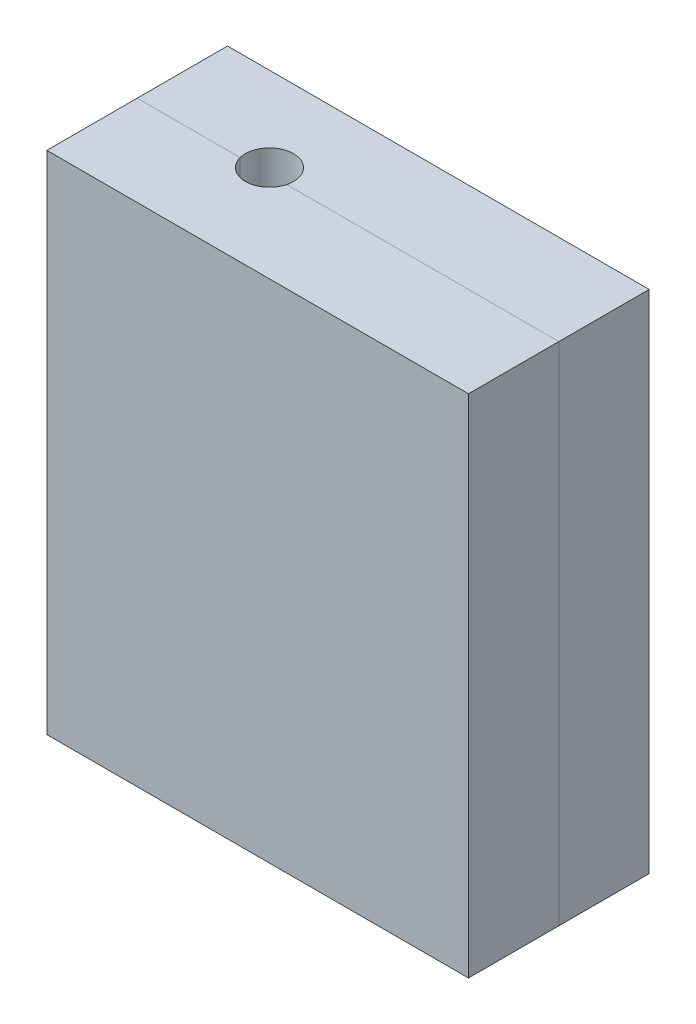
SolidWorks part; units mm, degrees
ref_plane "Front Plane" through (0, 0, 0) normal (0, 0, 1) x (1, 0, 0)
ref_plane "Top Plane" through (0, 0, 0) normal (0, 1, 0) x (1, 0, 0)
ref_plane "Right Plane" through (0, 0, 0) normal (1, 0, 0) x (0, 0, -1)
sketch "Sketch1" plane through (0, 0, 0) normal (0, 0, 1) x (1, 0, 0)
  line L1 (0, 0) -> (250, 0)
  line L2 (0, 0) -> (0, 300)
  line L3 (0, 300) -> (250, 300)
  line L4 (250, 0) -> (250, 300)
  dimension "D1" = 250
  dimension "D2" = 300
sketch "Sketch2" plane through (0, 0, 0) normal (0, 0, 1) x (1, 0, 0)
  line L0 (0, 280) -> (0, 20)
  line L1 (20, 0) -> (230, 0)
  line L2 (250, 20) -> (250, 280)
  line L3 (230, 300) -> (70, 300)
  line L4 (35, 300) -> (35, 320)
  line L5 (35, 320) -> (70, 320)
  line L6 (70, 320) -> (70, 300)
  line L8 (215, 67.5) -> (200, 67.5)
  line L9 (200, 67.5) -> (155, 112.5)
  line L10 (155, 112.5) -> (155, 187.5)
  line L11 (155, 187.5) -> (200, 232.5)
  line L12 (200, 232.5) -> (215, 232.5)
  line L13 (215, 150) -> (155, 150) construction
  line L14 (215, 232.5) -> (215, 67.5)
  line L15 (35, 300) -> (20, 300)
  arc A0 (0, 20) -> (20, 0) centre (20, 20) ccw
  arc A1 (230, 0) -> (250, 20) centre (230, 20) ccw
  arc A2 (250, 280) -> (230, 300) centre (230, 280) ccw
  arc A3 (0, 280) -> (20, 300) centre (20, 280) cw
  point P10 (0, 0)
  point P13 (250, 0)
  point P16 (250, 300)
  point P19 (0, 300)
  point P34 (250, 150)
  dimension "D1" = 20
  dimension "D2" = 35
  dimension "D3" = 165
  dimension "D4" = 15
  dimension "D5" = 60
  dimension "D6" = 35
  dimension "D7" = 20
  dimension "D8" = 15
sketch "Sketch3" plane through (0, 0, 0) normal (0, 0, 1) x (1, 0, 0)
  line L0 (230, 300) -> (70, 300) construction
  line L4 (35, 300) -> (20, 300) construction
  line L5 (0, 280) -> (0, 20) construction
  line L6 (20, 0) -> (230, 0) construction
  line L7 (250, 20) -> (250, 280) construction
  line L8 (230, 300) -> (70, 300)
  line L12 (70, 300) -> (20, 300)
  line L13 (0, 280) -> (0, 20)
  line L14 (20, 0) -> (230, 0)
  line L15 (250, 20) -> (250, 280)
  arc A0 (20, 300) -> (0, 280) centre (20, 280) ccw construction
  arc A1 (0, 20) -> (20, 0) centre (20, 20) ccw construction
  arc A2 (230, 0) -> (250, 20) centre (230, 20) ccw construction
  arc A3 (250, 280) -> (230, 300) centre (230, 280) ccw construction
  arc A4 (20, 300) -> (0, 280) centre (20, 280) ccw
  arc A5 (0, 20) -> (20, 0) centre (20, 20) ccw
  arc A6 (230, 0) -> (250, 20) centre (230, 20) ccw
  arc A7 (250, 280) -> (230, 300) centre (230, 280) ccw
extrude "Boss-Extrude1" add sketch "Sketch3" along normal blind 50 draft 2
sketch "Sketch4" plane through (0, 0, 50) normal (0, 0, 1) x (1, 0, 0)
  line L0 (215, 232.5) -> (215, 67.5) construction
  line L1 (215, 67.5) -> (200, 67.5) construction
  line L2 (200, 67.5) -> (155, 112.5) construction
  line L3 (155, 112.5) -> (155, 187.5) construction
  line L4 (155, 187.5) -> (200, 232.5) construction
  line L5 (200, 232.5) -> (215, 232.5) construction
  line L6 (215, 232.5) -> (215, 67.5)
  line L7 (215, 67.5) -> (200, 67.5)
  line L8 (200, 67.5) -> (155, 112.5)
  line L9 (155, 112.5) -> (155, 187.5)
  line L10 (155, 187.5) -> (200, 232.5)
  line L11 (200, 232.5) -> (215, 232.5)
extrude "Cut-Extrude1" cut sketch "Sketch4" against normal blind 15 draft 10
sketch "Sketch5" plane through (0, 0, 50) normal (0, 0, 1) x (1, 0, 0)
  line L0 (37.5, 222.5) -> (37.5, 77.5) construction
  line L1 (45, 222.5) -> (45, 77.5)
  line L2 (30, 222.5) -> (30, 77.5)
  line L4 (37.5, 150) -> (142.9758, 150) construction
  line L5 (67.5, 222.5) -> (67.5, 77.5) construction
  line L6 (75, 222.5) -> (75, 77.5)
  line L7 (60, 222.5) -> (60, 77.5)
  line L8 (97.5, 222.5) -> (97.5, 77.5) construction
  line L9 (105, 222.5) -> (105, 77.5)
  line L10 (90, 222.5) -> (90, 77.5)
  arc A0 (45, 222.5) -> (30, 222.5) centre (37.5, 222.5) ccw
  arc A1 (30, 77.5) -> (45, 77.5) centre (37.5, 77.5) ccw
  arc A2 (75, 222.5) -> (60, 222.5) centre (67.5, 222.5) ccw
  arc A3 (60, 77.5) -> (75, 77.5) centre (67.5, 77.5) ccw
  arc A4 (105, 222.5) -> (90, 222.5) centre (97.5, 222.5) ccw
  arc A5 (90, 77.5) -> (105, 77.5) centre (97.5, 77.5) ccw
  point P2 (37.5, 150)
  point P15 (67.5, 150)
  point P22 (97.5, 150)
  dimension "D1" = 15
  dimension "D2" = 145
  dimension "D3" = 30
  dimension "D4" = 3
extrude "Cut-Extrude2" cut sketch "Sketch5" against normal blind 5 draft 10
fillet "Fillet1" radius 10 8 edges at (242.9075, 292.9075, 50) (248.254, 150, 50) (242.9075, 7.0925, 50) (125, 1.746, 50) (7.0925, 7.0925, 50) (1.746, 150, 50) (7.0925, 292.9075, 50) (125, 298.254, 50)
sketch "Sketch6" plane through (0, 0, 0) normal (0, 0, -1) x (-1, 0, 0)
  line L4 (-250, 280) -> (-250, 20)
  line L5 (-230, 0) -> (-20, 0)
  line L6 (0, 20) -> (0, 280)
  line L7 (-20, 300) -> (-230, 300)
  line L8 (-250, 280) -> (-250, 20)
  line L9 (-230, 0) -> (-20, 0)
  line L10 (0, 20) -> (0, 280)
  line L11 (-20, 300) -> (-230, 300)
  arc A4 (-230, 300) -> (-250, 280) centre (-230, 280) ccw
  arc A5 (-250, 20) -> (-230, 0) centre (-230, 20) ccw
  arc A6 (-20, 0) -> (0, 20) centre (-20, 20) ccw
  arc A7 (0, 280) -> (-20, 300) centre (-20, 280) ccw
  arc A8 (-230, 300) -> (-250, 280) centre (-230, 280) ccw
  arc A9 (-250, 20) -> (-230, 0) centre (-230, 20) ccw
  arc A10 (-20, 0) -> (0, 20) centre (-20, 20) ccw
  arc A11 (0, 280) -> (-20, 300) centre (-20, 280) ccw
  dimension "D1" = 0
extrude "Boss-Extrude2" add sketch "Sketch6" along normal blind 5
fillet "Fillet2" radius 5 18 edges at (155, 150, 50) (177.5, 90, 50) (177.5, 210, 50) (207.5, 67.5, 50) (207.5, 232.5, 50) (212.3551, 150, 35) (206.7253, 70.1449, 35) (179.3702, 91.8702, 35) (157.6449, 150, 35) (179.3702, 208.1298, 35) (206.7253, 229.8551, 35) (215, 150, 50) (200.5478, 231.1775, 42.5) (156.3225, 113.0478, 42.5) (200.5478, 68.8225, 42.5) (213.6775, 68.8225, 42.5) (213.6775, 231.1775, 42.5) (156.3225, 186.9522, 42.5)
fillet "Fillet3" radius 3 24 edges at (37.5, 70, 50) (30, 150, 50) (37.5, 230, 50) (67.5, 70, 50) (60, 150, 50) (67.5, 230, 50) (97.5, 70, 50) (90, 150, 50) (97.5, 230, 50) (45, 150, 50) (75, 150, 50) (97.5, 229.1184, 45) (90.8816, 150, 45) (97.5, 70.8816, 45) (67.5, 229.1184, 45) (60.8816, 150, 45) (67.5, 70.8816, 45) (37.5, 229.1184, 45) (30.8816, 150, 45) (37.5, 70.8816, 45) (44.1184, 150, 45) (74.1184, 150, 45) (105, 150, 50) (104.1184, 150, 45)
mirror "Mirror1" about plane through (230, 280, -5) normal (0, 0, -1)
sketch "Sketch7" plane through (0, 300, 0) normal (0, 1, 0) x (1, 0, 0)
  circle A0 centre (54.8055, 5) radius 20
  dimension "D1" = 40
  dimension "D2" = 5
  dimension "D3" = 54.8055
extrude "Boss-Extrude3" add sketch "Sketch7" along normal mid plane 40
fillet "Fillet4" radius 5 4 edges at (34.8055, 300, -5) (54.8055, 299.4762, 15) (74.8055, 300, -5) (54.8055, 299.4762, -25)
shell "Shell1" [suppressed] thickness 4
sketch "Sketch8" plane through (0, 0, 0) normal (0, 0, 1) x (1, 0, 0)
  line L1 (-50, -50) -> (300, -50)
  line L2 (-50, -50) -> (-50, 370)
  line L3 (-50, 370) -> (300, 370)
  line L4 (300, -50) -> (300, 370)
  dimension "D1" = 50
  dimension "D2" = 50
  dimension "D3" = 350
  dimension "D4" = 420
extrude "Boss-Extrude4" add sketch "Sketch8" along normal mid plane 150 separate body
combine bodies "Combine1" operation type subtract main body 107 bodies to subtract 106
split "Split1" trim tools "Front Plane" bodies to split 108 resulting bodies 109 110
sketch "Sketch9" plane through (0, 370, 0) normal (0, 1, 0) x (1, 0, 0)
  arc A1 (35.4406, 0) -> (74.1704, 0) centre (54.8055, 5) ccw construction
  arc A2 (74.1704, 0) -> (35.4406, 0) centre (54.8055, 5) ccw construction
  arc A3 (35.4406, 0) -> (74.1704, 0) centre (54.8055, 5) ccw
  arc A4 (74.1704, 0) -> (35.4406, 0) centre (54.8055, 5) ccw
extrude "Cut-Extrude3" cut sketch "Sketch9" against normal blind 60
